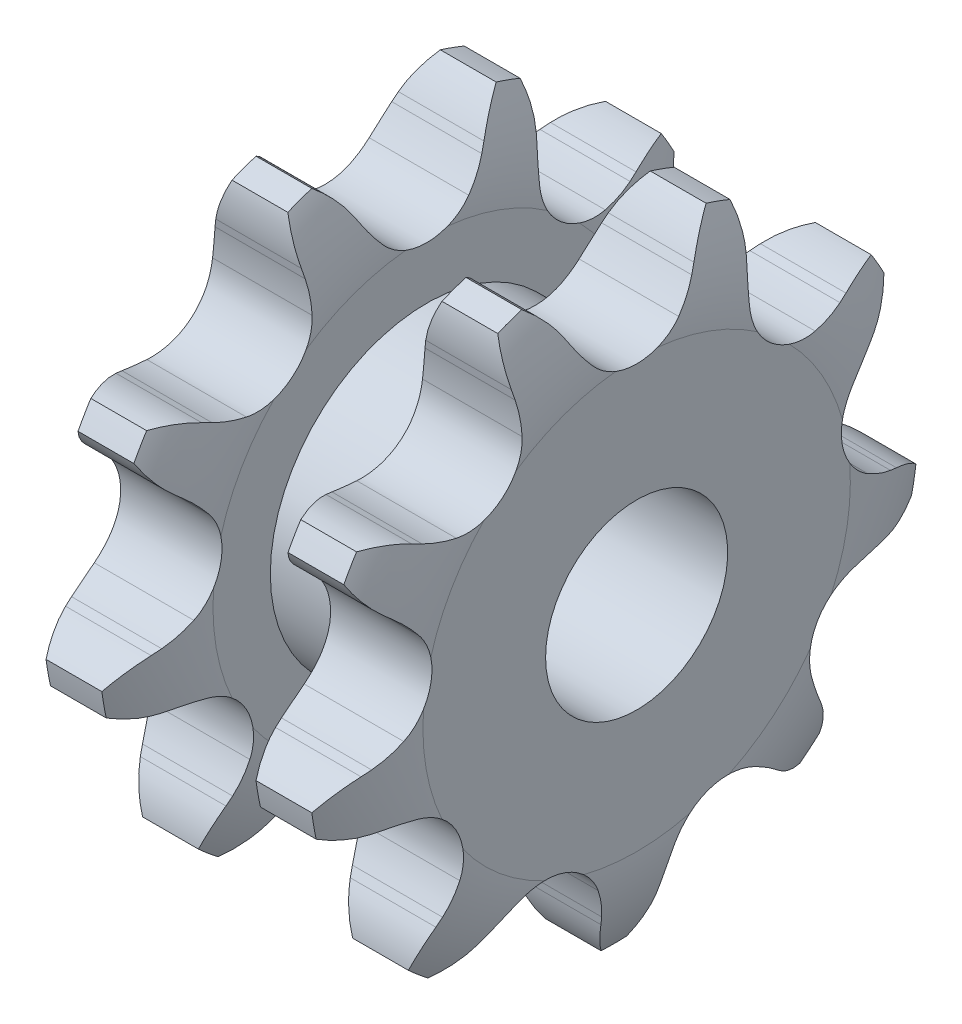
SolidWorks part; units mm, degrees
ref_plane "Plane1" through (0, 0, 0) normal (0, 0, 1) x (1, 0, 0)
ref_plane "Plane2" through (0, 0, 0) normal (0, 1, 0) x (1, 0, 0)
ref_plane "Plane3" through (0, 0, 0) normal (1, 0, 0) x (0, 0, -1)
sketch "Clipboard" plane through (0, 0, 0) normal (0, 1, 0) x (1, 0, 0)
  line L0 (0, 0) -> (25.0873, -3.9734)
  line L1 (-15, 0) -> (100, 0) construction
  line L2 (0, 0) -> (-2.1039, 2.3779)
  line L3 (0, 0) -> (-11.863, 4.5341)
  line L4 (0, 0) -> (15.6796, 2.4834)
  line L5 (0, 0) -> (-47.5972, -17.7524)
  line L6 (0, 0) -> (-35.9946, -24.2857)
  line L7 (-2.1039, 2.3779) -> (47.7628, 12.071)
  line L8 (-76.2, 38.1) -> (-47.9044, 38.1)
  line L9 (-73.2054, 38.5461) -> (-73.0531, 38.5485)
  line L10 (-73.0533, 76.1892) -> (-43.7671, 76.1892)
  circle A0 centre (0, 0) radius 7.9375
  circle A1 centre (0, 0) radius 21.812
  circle A2 centre (0, 0) radius 25.4
  dimension "Dr" = 15.875
  dimension "MHD" = 43.6239
  dimension "Hub_dia" = 50.8
  dimension "Num_teeth" = 9
  dimension "Pitch" = 25.4
  dimension "Width" = 15.875
  dimension "Chamfer_wid" = 3.175
  dimension "Chamfer_dep" = 12.7
  dimension "Overall_len" = 50.8
  dimension "Show_teeth" = 9
  dimension "Thickness" = 43.4213
  dimension "OAL" = 50.8001
  dimension "T_dim" = 28.2956
  dimension "Width_const" = 0.1524
  dimension "Width_factor" = 0.9
  dimension "Num_strands" = 2
  dimension "Transv_pitch" = 29.2862
sketch "BasProSke" plane through (0, 0, 0) normal (0, 1, 0) x (1, 0, 0)
  line L0 (-10, 0) -> (60, 0) construction
  line L1 (0, 0) -> (0, 29.813)
  line L2 (0, 0) -> (43.4213, 0)
  line L3 (43.4213, 0) -> (43.4213, 29.813)
  line L4 (40.2463, 42.513) -> (3.175, 42.513)
  arc A0 (0, 29.813) -> (3.175, 42.513) centre (26.9875, 29.813) cw
  arc A1 (43.4213, 29.813) -> (40.2463, 42.513) centre (16.4338, 29.813) ccw
  dimension "D1" = 26.9875
  dimension "G1" = 3.175
  dimension "G2" = 3.175
  dimension "H2" = 12.7
  dimension "Diameter" = 85.0259
  dimension "H1" = 12.7
  dimension "Thickness" = 43.4213
revolve "Base-Revolve" add sketch "BasProSke" angle 360 about L0
sketch "GrvSke" plane through (0, 0, 0) normal (0, 1, 0) x (1, 0, 0)
  line L0 (14.1351, 29.813) -> (14.1351, 21.812)
  line L1 (14.1351, 21.812) -> (29.2862, 21.812)
  line L2 (29.2862, 21.812) -> (29.2862, 29.813)
  line L3 (10.9601, 42.513) -> (32.4612, 42.513)
  line L4 (21.7106, 0) -> (21.7106, 52.07) construction
  line L5 (-10, 0) -> (60, 0) construction
  line L6 (0, 0) -> (35.56, 0) construction
  arc A0 (29.2862, 29.813) -> (32.4612, 42.513) centre (56.2737, 29.813) cw
  arc A1 (14.1351, 29.813) -> (10.9601, 42.513) centre (-12.8524, 29.813) ccw
  dimension "Diameter" = 85.0259
  dimension "H1" = 12.7
  dimension "Grv_diam" = 43.6239
  dimension "Grv_width" = 15.1511
  dimension "Offset" = 21.7106
  dimension "G1" = 3.175
revolve "Groove" cut sketch "GrvSke" angle 360 about L6
pattern_linear "Grooves" [suppressed]
sketch "TooCutSke" plane through (0, 0, 0) normal (1, 0, 0) x (0, 0, -1)
  line L0 (8.4728, 35.2524) -> (9.083, 36.3141)
  line L1 (0, 0) -> (0, 107) construction
  line L2 (0, 37.1323) -> (-10, 37.1323) construction
  line L3 (-8.4728, 35.2524) -> (-9.083, 36.3141)
  arc A0 (5.9876, 31.8038) -> (8.4728, 35.2524) centre (-9.4872, 45.5752) ccw
  arc A1 (5.9876, 31.8038) -> (-5.9876, 31.8038) centre (0, 37.1323) cw
  arc A2 (9.083, 36.3141) -> (20.8847, 43.143) centre (20.8847, 29.5309) cw
  arc A3 (-5.9876, 31.8038) -> (-8.4728, 35.2524) centre (9.4872, 45.5752) cw
  arc A4 (-9.083, 36.3141) -> (-20.8847, 43.143) centre (-20.8847, 29.5309) ccw
  arc A5 (20.8847, 43.143) -> (-20.8847, 43.143) centre (0, 0) ccw
  dimension "R" = 8.0153
  dimension "E" = 20.7153
  dimension "F" = 13.6121
  dimension "Pitch_radius" = 37.1323
  dimension "W" = 20.8847
  dimension "V" = 7.6014
  dimension "A" = 41.667
  dimension "B" = 11.778
extrude "ToothCut" cut sketch "TooCutSke" along normal through all
pattern_circular "TeethCuts" count 9 every 40 about axis through (-10, 0, 0) along (1, 0, 0) of "ToothCut"
sketch "HubNeaOneSke" plane through (0, 0, 0) normal (-1, 0, 0) x (0, 0, 1)
  circle A0 centre (0, 0) radius 21.812
  dimension "Diameter" = 43.6239
extrude "HubNearOne" [suppressed] add sketch "HubNeaOneSke" along normal blind 7.3788
sketch "HubNeaBotSke" plane through (0, 0, 0) normal (-1, 0, 0) x (0, 0, 1)
  circle A0 centre (0, 0) radius 21.812
  dimension "Diameter" = 43.6239
extrude "HubNearBoth" [suppressed] add sketch "HubNeaBotSke" along normal blind 3.6894
ref_plane "FarPln" through (43.4213, 0, 0) normal (1, 0, 0) x (0, 0, -1)
sketch "HubFarSke" plane through (43.4213, 0, 0) normal (1, 0, 0) x (0, 0, -1)
  circle A0 centre (0, 0) radius 21.812
  dimension "Diameter" = 43.6239
extrude "HubFar" [suppressed] add sketch "HubFarSke" along normal blind 3.6894
sketch "BorSke" plane through (0, 0, 0) normal (1, 0, 0) x (0, 0, -1)
  circle A0 centre (0, 0) radius 12.7
  dimension "Diameter" = 25.4
extrude "Bore" cut sketch "BorSke" along normal mid plane 101.6001
sketch "KeySke" plane through (0, 0, 0) normal (1, 0, 0) x (0, 0, -1)
  line L0 (-3.175, 0) -> (-3.175, 15.5956)
  line L1 (-3.175, 15.5956) -> (3.175, 15.5956)
  line L2 (3.175, 15.5956) -> (3.175, 0)
  line L3 (0, 0) -> (0, 34) construction
  line L4 (-3.175, 0) -> (3.175, 0)
  dimension "Offset" = 15.5956
  dimension "Width" = 6.35
extrude "Keyway" [suppressed] cut sketch "KeySke" along normal mid plane 101.6001
pattern_circular "Keyway2" [suppressed] count 2 every 90 about axis through (-10, 0, 0) along (1, 0, 0)
equation "\"Num_teeth@Clipboard\" = int( \"Num_teeth@Clipboard\" )"
equation "\"Num_teeth@Clipboard\" = ((sgn( \"Num_teeth@Clipboard\" - 5.0)+1)*( \"Num_teeth@Clipboard\" - 5.0))/2 +5.0"
equation "\"Num_teeth@Clipboard\" = ((sgn( \"Num_teeth@Clipboard\" - 200.0)-1)*( \"Num_teeth@Clipboard\" - 200.0))/-2 +200.0"
equation "\"MHD@Clipboard\" = \"Pitch@Clipboard\" * (1.0 / tan(3.14159265 / \"Num_teeth@Clipboard\" ) - 1.0) - 0.03"
equation "\"Thickness@Clipboard\"  = \"Width@Clipboard\" * \"Width_factor@Clipboard\" - \"Width_const@Clipboard\" + (\"Num_strands@Clipboard\" - 1) * \"Transv_pitch@Clipboard\""
equation "\"OAL@Clipboard\" = \"Thickness@Clipboard\""
equation "\"MHD@Clipboard\" = ((sgn( \"MHD@Clipboard\" - \"Hub_dia@Clipboard\" )-1)*( \"MHD@Clipboard\" - \"Hub_dia@Clipboard\" ))/-2+ \"Hub_dia@Clipboard\""
equation "\"OAL@Clipboard\" = ((sgn( \"OAL@Clipboard\" - \"Overall_len@Clipboard\" )+1)*( \"OAL@Clipboard\" - \"Overall_len@Clipboard\" ))/2 + \"Overall_len@Clipboard\" + 0.000002"
equation "\"Num_teeth@TeethCuts\" = int( \"Show_teeth@Clipboard\" ) + 1"
equation "\"Num_teeth@TeethCuts\" = ((sgn( \"Num_teeth@TeethCuts\" - \"Num_teeth@Clipboard\" )-1)*( \"Num_teeth@TeethCuts\" - \"Num_teeth@Clipboard\" ))/-2+ \"Num_teeth@Clipboard\""
equation "\"Num_teeth@TeethCuts\" = ((sgn( \"Num_teeth@TeethCuts\" - 2.0)+1)*( \"Num_teeth@TeethCuts\" - 2.0))/2 +2.0"
equation "\"Angle@TeethCuts\" = 360.0 / \"Num_teeth@Clipboard\""
equation "\"Pitch_radius@TooCutSke\" = ( \"Pitch@Clipboard\" / 2.0) / sin(3.14159265 / \"Num_teeth@Clipboard\" )  'ma"
equation "\"R@TooCutSke\"  = \"Dr@Clipboard\" * 0.5025 + 0.0015"
equation "\"A@TooCutSke\" = 35.0 + (60.0 / \"Num_teeth@Clipboard\")"
equation "\"E@TooCutSke\"  = \"Dr@Clipboard\" * 1.3025 + 0.0015"
equation "\"B@TooCutSke\"  = 18.0 - (56.0 / \"Num_teeth@Clipboard\" )"
equation "\"W@TooCutSke\" = 1.4 * \"Dr@Clipboard\" * cos(3.14159265 / \"Num_teeth@Clipboard\" )"
equation "\"V@TooCutSke\" = 1.4 * \"Dr@Clipboard\" * sin(3.14159265 / \"Num_teeth@Clipboard\" )"
equation "\"Diameter@BasProSke\" = 2.0 * ( (0.3 * \"Pitch@Clipboard\" ) +  \"Pitch@Clipboard\" / 2.0 / tan(3.14159265 / \"Num_teeth@Clipboard\" ))"
equation "\"Thickness@BasProSke\"  = \"Thickness@Clipboard\""
equation "\"G1@BasProSke\" =  \"Chamfer_wid@Clipboard\""
equation "\"G2@BasProSke\" =  \"Chamfer_wid@Clipboard\""
equation "\"H1@BasProSke\" =  \"Chamfer_dep@Clipboard\""
equation "\"H2@BasProSke\" =  \"Chamfer_dep@Clipboard\""
equation "\"Diameter@GrvSke\" = \"Diameter@BasProSke\""
equation "\"G1@GrvSke\" = \"Chamfer_wid@Clipboard\""
equation "\"H1@GrvSke\" = \"Chamfer_dep@Clipboard\""
equation "\"Grv_diam@GrvSke\" =  \"Pitch@Clipboard\" * (1.0 / tan(3.14159265 / \"Num_teeth@Clipboard\" ) - 1.0) - 0.03"
equation "\"Grv_width@GrvSke\" =  \"Transv_pitch@Clipboard\" - ( \"Width@Clipboard\" * \"Width_factor@Clipboard\" - \"Width_const@Clipboard\" )"
equation "\"Offset@GrvSke\" = \"Grv_width@GrvSke\" / 2.0 + ( \"Width@Clipboard\" * \"Width_factor@Clipboard\" - \"Width_const@Clipboard\" )"
equation "\"Offset@Grooves\" = \"Transv_pitch@Clipboard\""
equation "\"Num_grvs@Grooves\" = \"Num_strands@Clipboard\""
equation "\"Num_grvs@Grooves\" = \"Num_grvs@Grooves\" - 1 * sgn( \"Num_grvs@Grooves\" -1)"
equation "\"Diameter@HubNeaOneSke\" = \"MHD@Clipboard\""
equation "\"Length@HubNearOne\" = \"OAL@Clipboard\" - \"Thickness@BasProSke\""
equation "\"Diameter@HubNeaBotSke\" = \"MHD@Clipboard\""
equation "\"Length@HubNearBoth\" = ( \"OAL@Clipboard\" - \"Thickness@BasProSke\" ) / 2.0"
equation "\"Thickness@FarPln\" = \"Thickness@BasProSke\""
equation "\"Diameter@HubFarSke\" = \"MHD@Clipboard\""
equation "\"Length@HubFar\" = ( \"OAL@Clipboard\" - \"Thickness@BasProSke\" ) / 2.0"
equation "\"D1@Bore\" = \"OAL@Clipboard\" * 2.0"
equation "\"D1@Keyway\" = \"OAL@Clipboard\" * 2.0"
equation "\"Offset@KeySke\" = \"T_dim@Clipboard\" - \"Diameter@BorSke\" / 2.0"
